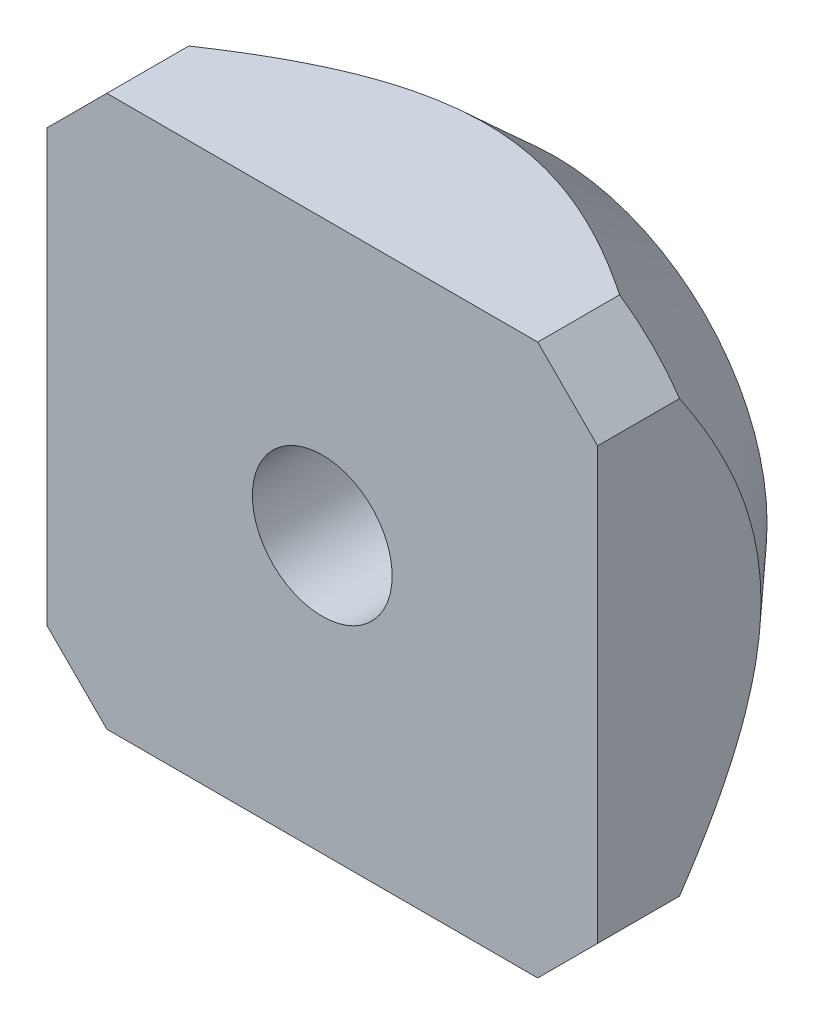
SolidWorks part; units mm, degrees
ref_plane "Front" through (0, 0, 0) normal (0, 0, 1) x (1, 0, 0)
ref_plane "Top" through (0, 0, 0) normal (0, 1, 0) x (1, 0, 0)
ref_plane "Right" through (0, 0, 0) normal (1, 0, 0) x (0, 0, -1)
imported_body "Imported1"
hole_wizard "M4x0.7 Tapped Hole1" positions "3DSketch1" profile "Sketch1" tap size "M4x0.7" standard "Ansi Metric"
sketch3d "3DSketch1"
  line L0 (-6.5, 5.0858, 0) -> (-6.5, -5.0858, 0) construction
  line L1 (5.0858, 6.5, 0) -> (-5.0858, 6.5, 0) construction
  point P0 (0, 0, 0)
  dimension "D1" = 6.5
  dimension "D2" = 6.5
sketch "Sketch1" plane through (0, 0, 0) normal (1, 0, 0) x (0, -1, 0)
  line L0 (0, 0) -> (0, 12.4914)
  line L1 (0, 12.4914) -> (1.65, 11.5)
  line L2 (1.65, 11.5) -> (1.65, 0)
  line L5 (1.65, 0) -> (0, 0)
  line L10 (0, 12.4914) -> (-1.65, 11.5) construction
  line L11 (0, -6.35) -> (0, 107.95) construction
  dimension "Tap Drill Dia." = 3.3
  dimension "Tap Drill Depth" = 11.5
  dimension "Drill Angle" = 118
